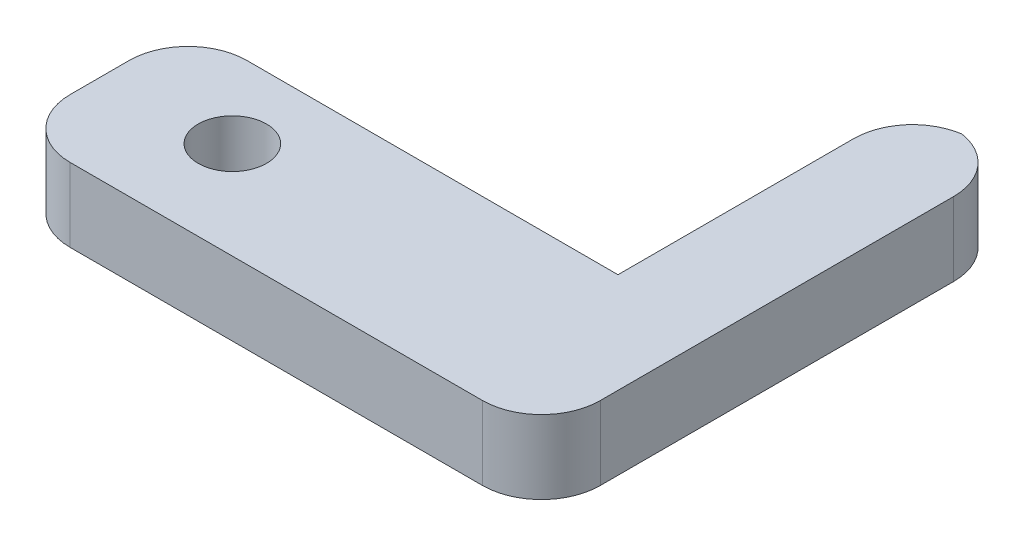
SolidWorks part; units mm, degrees
ref_plane "Front Plane" through (0, 0, 0) normal (0, 0, 1) x (1, 0, 0)
ref_plane "Top Plane" through (0, 0, 0) normal (0, 1, 0) x (1, 0, 0)
ref_plane "Right Plane" through (0, 0, 0) normal (1, 0, 0) x (0, 0, -1)
sketch "Sketch1" plane through (0, 0, 0) normal (0, 1, 0) x (1, 0, 0)
  line L1 (0, 0) -> (22.86, 0)
  line L2 (0, 0) -> (0, 7.62)
  line L3 (0, 7.62) -> (18.542, 7.62)
  line L6 (22.86, 0) -> (22.86, 20.32)
  line L7 (22.86, 20.32) -> (18.542, 20.32)
  line L8 (18.542, 7.62) -> (18.542, 20.32)
  dimension "D1" = 7.62
  dimension "D2" = 4.318
  dimension "D3" = 18.542
  dimension "D4" = 12.7
extrude "Boss-Extrude1" add sketch "Sketch1" along normal blind 3.175
fillet "Fillet1" radius 2.54 5 edges at (0, 1.5875, -7.62) (0, 1.5875, 0) (22.86, 1.5875, -20.32) (18.542, 1.5875, -20.32) (22.86, 1.5875, 0)
hole_wizard "#4 Clearance Hole1" positions "Sketch3" profile "Sketch2" hole size "#4" standard "ANSI Inch"
sketch "Sketch3" plane through (0, 3.175, 0) normal (0, 1, 0) x (1, 0, 0)
  line L0 (18.542, 17.78) -> (18.542, 7.62) construction
  point P0 (5.334, 4.1974)
  dimension "D1" = 13.208
sketch "Sketch2" plane through (5.334, 3.175, -4.1974) normal (1, 0, 0) x (0, 0, 1)
  line L0 (0, 0) -> (0, 3.175)
  line L1 (0, 3.175) -> (1.4732, 3.175)
  line L2 (1.4732, 3.175) -> (1.4732, 0)
  line L5 (1.4732, 0) -> (0, 0)
  line L11 (0, -6.35) -> (0, 107.95) construction
  dimension "Thru Hole Dia." = 2.9464
  dimension "Thru Hole Depth" = 3.175
